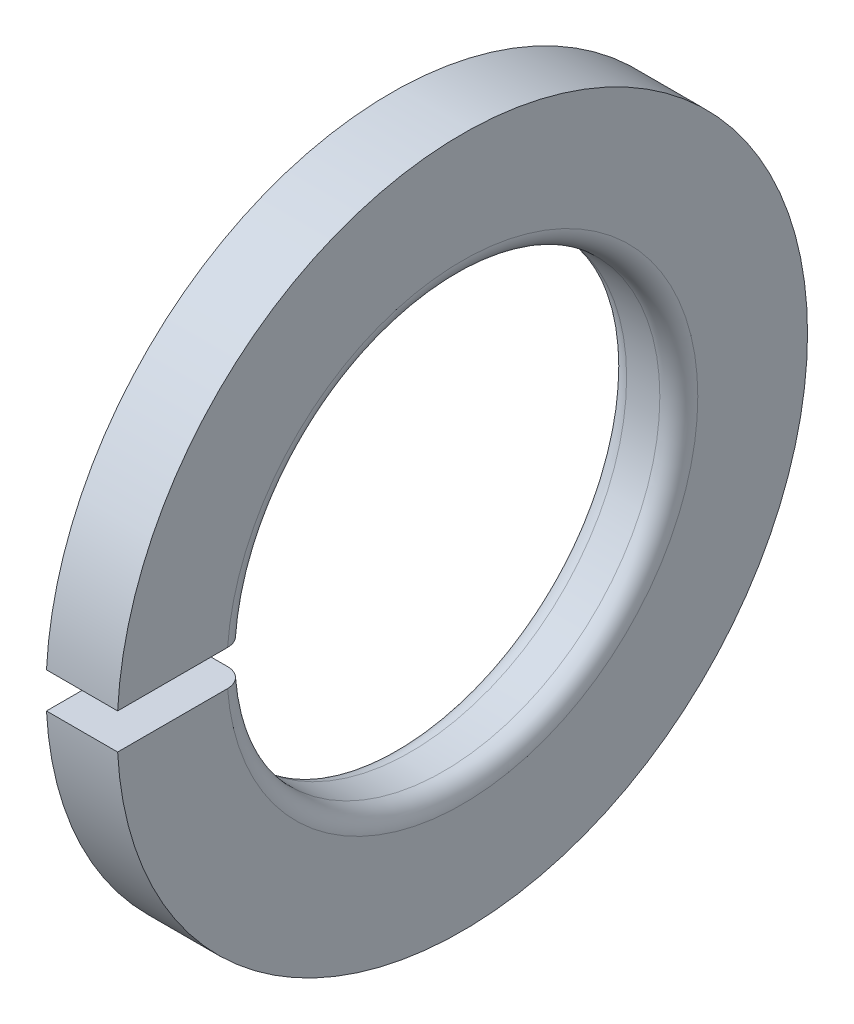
SolidWorks part; units mm, degrees
ref_plane "Plane1" through (0, 0, 0) normal (0, 0, 1) x (1, 0, 0)
ref_plane "Plane2" through (0, 0, 0) normal (0, 1, 0) x (1, 0, 0)
ref_plane "Plane3" through (0, 0, 0) normal (1, 0, 0) x (0, 0, -1)
sketch "Sketch1" plane through (0, 0, 0) normal (0, 0, 1) x (1, 0, 0)
  line L0 (-34.925, 0) -> (9.525, 0) construction
  line L1 (0, 19.85) -> (0, 29.1)
  line L2 (0, 29.1) -> (-6, 29.1)
  line L3 (-6, 29.1) -> (-6, 19.85)
  line L4 (-4.4, 18.25) -> (-1.6, 18.25)
  arc A0 (-4.4, 18.25) -> (-6, 19.85) centre (-4.4, 19.85) cw
  arc A1 (0, 19.85) -> (-1.6, 18.25) centre (-1.6, 19.85) cw
  point P8 (-6, 18.25)
revolve "Base-Revolve" add sketch "Sketch1" angle 360 about L0
sketch "Sketch2" plane through (0, 0, 0) normal (-1, 0, 0) x (0, -1, 0)
  line L0 (-1.5, 0) -> (1.5, 0)
  line L1 (0, 0) -> (0, 12.7) construction
  line L2 (1.5, 0) -> (1.5, 29.682)
  line L3 (1.5, 29.682) -> (-1.5, 29.682)
  line L4 (-1.5, 29.682) -> (-1.5, 0)
extrude "Gap" cut sketch "Sketch2" along normal through all
equation "\"D1@Sketch1\" = \"Fillet_rad@Sketch1\""
equation "\"D1@Sketch2\" = \"Thickness@Sketch1\" * 0.5"
equation "\"D2@Sketch2\" = \"Outside_dia@Sketch1\" * 0.51"
